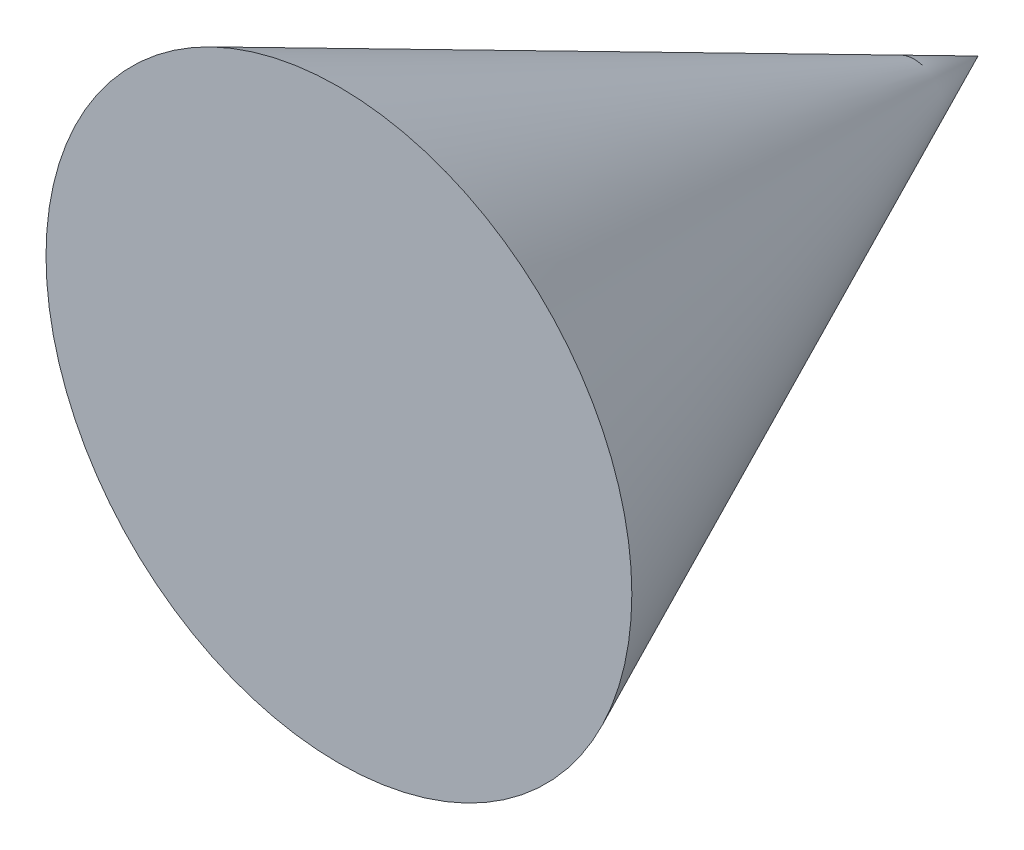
SolidWorks part; units mm, degrees
ref_plane "前视基准面" through (0, 0, 0) normal (0, 0, 1) x (1, 0, 0)
ref_plane "上视基准面" through (0, 0, 0) normal (0, 1, 0) x (1, 0, 0)
ref_plane "右视基准面" through (0, 0, 0) normal (1, 0, 0) x (0, 0, -1)
sketch "草图1" plane through (0, 0, 0) normal (0, 1, 0) x (1, 0, 0)
  line L0 (0, 54.1618) -> (0, -64.2471) construction
  line L1 (0, 40.3438) -> (-25, -14.1997)
  line L2 (-25, -14.1997) -> (0, -14.1997)
  line L3 (0, 40.3438) -> (0, -14.1997)
  dimension "D1" = 60
  dimension "D2" = 25
revolve "旋转1" add sketch "草图1" angle 360 about L0
